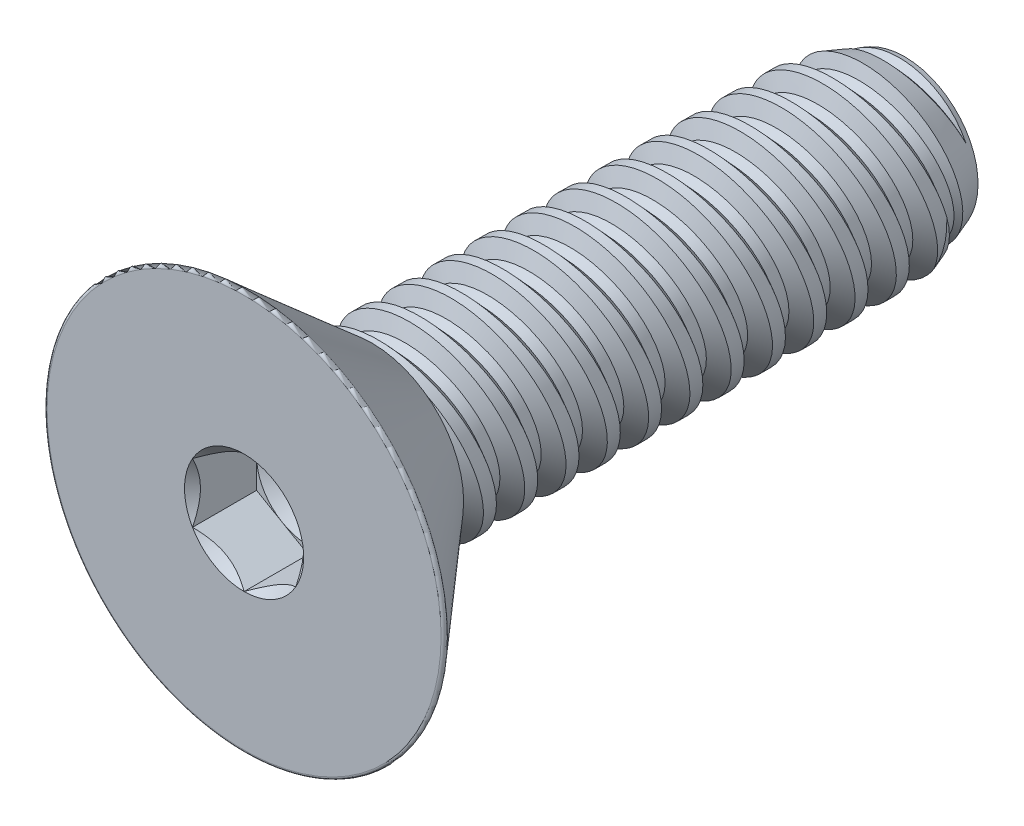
SolidWorks part; units mm, degrees
ref_plane "Front" through (0, 0, 0) normal (0, 0, 1) x (1, 0, 0)
ref_plane "Top" through (0, 0, 0) normal (0, 1, 0) x (1, 0, 0)
ref_plane "Right" through (0, 0, 0) normal (1, 0, 0) x (0, 0, -1)
sketch "Sketch1" plane through (0, 0, 0) normal (1, 0, 0) x (0, 0, -1)
  line L0 (0, 0) -> (-2.4638, 0) construction
  line L1 (0, 0) -> (10.2362, 0)
  line L2 (0, 0) -> (0, 1.7526)
  line L3 (0, 1.7526) -> (10.2362, 1.7526)
  line L4 (10.2362, 0) -> (10.2362, 1.7526)
  line L5 (0, -1.7526) -> (10.2362, -1.7526) construction
revolve "Revolve1" add sketch "Sketch1" angle 360 about L0
ref_plane "Plane1" through (0, 0, 2.4638) normal (0, 0, 1) x (1, 0, 0)
sketch "Sketch2" plane through (0, 0, 0) normal (1, 0, 0) x (0, 0, -1)
  line L0 (0, 1.7526) -> (0, -1.7526) construction
  line L1 (0, -1.7526) -> (0.7938, -1.7526) construction
  line L2 (0.7938, -1.7526) -> (0, 1.7526) construction
  line L3 (0, 1.7526) -> (0.0968, 1.7745) construction
  line L4 (0.0968, 1.7745) -> (0.7741, 1.9279)
  line L5 (0.7741, 1.9279) -> (0.6271, 1.4541)
  line L6 (0.6271, 1.4541) -> (0.4336, 1.4103)
  line L7 (0.4336, 1.4103) -> (0.0968, 1.7745)
  line L8 (0.5303, 1.4322) -> (0.4355, 1.8512) construction
  line L9 (0, -1.7526) -> (10.2362, -1.7526) construction
  line L10 (0, 1.7526) -> (10.2362, 1.7526) construction
  line L12 (0.4578, 1.7526) -> (1.2515, -1.7526) construction
  line L13 (0, -0.1935) -> (1.7093, 0.1935) construction
  line L15 (0, 0) -> (0, 1.7526) construction
  point P19 (0.8547, 0)
revolve "Cut-Revolve1" cut sketch "Sketch2" angle 360 about L13
sketch "Sketch3" plane through (0, 0, 0) normal (1, 0, 0) x (0, 0, -1)
  line L0 (10.2362, 1.4103) -> (9.2957, 1.7526)
  line L1 (9.2957, 1.7526) -> (10.2362, 1.7526)
  line L2 (10.2362, 1.7526) -> (10.2362, 1.4103)
  line L3 (0, 1.7526) -> (10.2362, 1.7526) construction
  line L4 (10.2362, 0) -> (10.2362, 1.7526) construction
  line L5 (9.2957, 0) -> (0, 0) construction
  line L6 (9.2957, 1.7526) -> (9.2957, -1.7526) construction
  line L7 (0, -1.7526) -> (10.2362, -1.7526) construction
  dimension "D1" = 20
  dimension "D2" = 3.5052
revolve "Cut-Revolve2" cut sketch "Sketch3" angle 360 about L5
pattern_linear "LPattern1" count 13 spacing 0.7937 along (0, 0, 1)
pattern_linear "LPattern2" count 2 spacing 0.7937 along (0, 0, 1)
sketch "Sketch4" plane through (0, 0, 0) normal (0, 0, 1) x (1, 0, 0)
  circle A0 centre (0, 0) radius 3.8989
  dimension "Head Dia" = 7.7978
extrude "Extrude1" add sketch "Sketch4" along normal up to surface (2.4638 mm away)
sketch "Sketch9" plane through (0, 0, 0) normal (1, 0, 0) x (0, 0, -1)
  line L0 (-2.4638, 3.8989) -> (0, 1.7572)
  line L1 (0, 1.7572) -> (0, 3.8989)
  line L2 (0, 3.8989) -> (-2.4638, 3.8989)
  line L3 (0, 0) -> (-2.4638, 0) construction
  line L6 (-2.4638, -3.8989) -> (0, -1.7572) construction
  line L7 (0, -3.8989) -> (0, 3.8989) construction
  line L8 (-2.4638, 3.8989) -> (-2.4638, -3.8989) construction
  line L9 (0, 3.8989) -> (-2.4638, 3.8989) construction
  dimension "D1" = 82
revolve "Cut-Revolve3" cut sketch "Sketch9" angle 360 about L3
fillet "Fillet1" radius 0.0508
sketch "Sketch6" plane through (0, 0, 2.4638) normal (0, 0, 1) x (1, 0, 0)
  line L1 (0, -1.1457) -> (0.9922, -0.5728)
  line L2 (0.9922, -0.5728) -> (0.9922, 0.5728)
  line L3 (0.9922, 0.5728) -> (0, 1.1457)
  line L4 (0, 1.1457) -> (-0.9922, 0.5728)
  line L5 (-0.9922, 0.5728) -> (-0.9922, -0.5728)
  line L6 (-0.9922, -0.5728) -> (0, -1.1457)
  circle A0 centre (0, 0) radius 0.9922 construction
  dimension "Hex" = 1.9844
extrude "Cut-Extrude1" cut sketch "Sketch6" against normal blind 1.2319
sketch "Sketch7" plane through (0, 0, 2.4638) normal (0, 0, 1) x (1, 0, 0)
  circle A0 centre (0, 0) radius 1.1457
extrude "Cut-Extrude4" cut sketch "Sketch7" against normal blind 1.2319 draft 45
sketch "Sketch8" plane through (0, 0, 1.2319) normal (0, 0, 1) x (1, 0, 0)
  circle A0 centre (0, 0) radius 0.9922 construction
  circle A1 centre (0, 0) radius 0.9922
extrude "Cut-Extrude5" cut sketch "Sketch8" against normal blind 0.4106 draft 60
equation "\"D2@Sketch2\"=\"Thread Pitch@Sketch2\"/8"
equation "\"D3@Sketch2\"=\"Thread Pitch@Sketch2\"/4"
equation "\"D4@Sketch2\"=\"Thread Pitch@Sketch2\""
equation "\"D3@LPattern1\"=\"Thread Pitch@Sketch2\""
equation "\"D1@Cut-Extrude1\"=\"Head Height@Sketch1\"/2"
equation "\"D1@Cut-Extrude4\"=\"D1@Cut-Extrude1\""
equation "\"D1@Cut-Extrude5\"=\"D1@Cut-Extrude1\"/3"
equation "\"D1@LPattern1\"=\"D1@Sketch1\"/\"Thread Pitch@Sketch2\""
equation "\"D3@LPattern2\"=\"Thread Pitch@Sketch2\""
